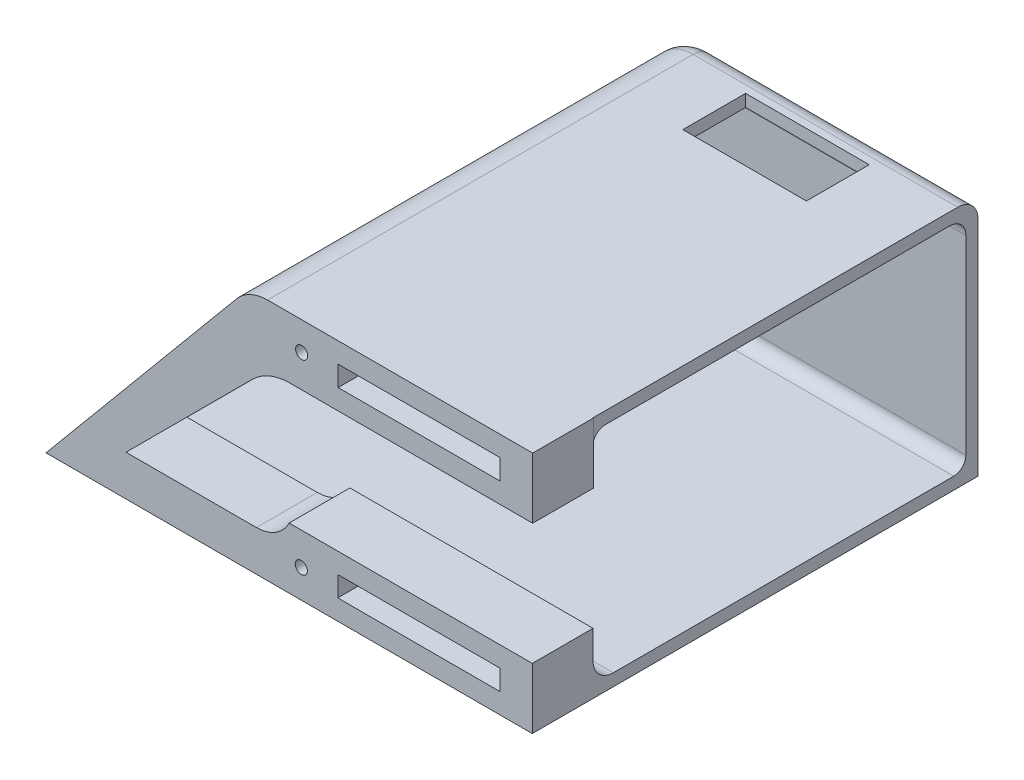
SolidWorks part; units mm, degrees
ref_plane "Front Plane" through (0, 0, 0) normal (0, 0, 1) x (1, 0, 0)
ref_plane "Top Plane" through (0, 0, 0) normal (0, 1, 0) x (1, 0, 0)
ref_plane "Right Plane" through (0, 0, 0) normal (1, 0, 0) x (0, 0, -1)
sketch "Sketch2" plane through (0, 0, 0) normal (0, 0, 1) x (1, 0, 0)
  line L0 (0, 0) -> (120, 0)
  line L1 (120, 0) -> (120, 60)
  line L2 (120, 60) -> (50, 60)
  line L3 (50, 60) -> (0, 0)
  dimension "D1" = 60
  dimension "D2" = 120
  dimension "D3" = 70
  dimension "D4" = 78.1025
extrude "Boss-Extrude1" add sketch "Sketch2" against normal blind 110
shell "Shell1" thickness 3
sketch "Sketch4" plane through (0, 0, 0) normal (0, 0, 1) x (1, 0, 0)
  line L0 (119.75, 50) -> (59.75, 50)
  line L1 (59.75, 50) -> (19.75, 10)
  line L2 (19.75, 10) -> (119.75, 10)
  line L3 (119.75, 10) -> (119.75, 50)
  line L4 (0, 0) -> (120, 0) construction
  line L5 (120, 60) -> (50, 60) construction
  line L6 (120, 0) -> (120, 60) construction
  dimension "D1" = 40
  dimension "D2" = 100
  dimension "D3" = 10
  dimension "D4" = 10
  dimension "D5" = 45
  dimension "D6" = 56.5685
  dimension "D7" = 40
  dimension "D8" = 0.25
extrude "Cut-Extrude1" cut sketch "Sketch4" against normal blind 78
sketch "Sketch5" plane through (0, 0, 0) normal (-0.7682, 0.6402, 0) x (0, 0, 1)
  line L0 (-110, 78.1025) -> (-110, 0) construction
  line L1 (-95, 53.25) -> (-24, 53.25)
  line L2 (-95, 53.25) -> (-95, 29)
  line L3 (-95, 29) -> (-24, 29)
  line L4 (-24, 53.25) -> (-24, 29)
  line L5 (-110, 0) -> (0, 0) construction
  dimension "D1" = 71
  dimension "D2" = 24.25
  dimension "D3" = 15
  dimension "D4" = 29
extrude "Cut-Extrude2" cut sketch "Sketch5" against normal blind 13.642
sketch "Sketch6" plane through (120, 0, 0) normal (1, 0, 0) x (0, 0, -1)
  line L0 (0, 50) -> (3, 50)
  line L1 (0, 0) -> (0, 60) construction
  line L2 (3, 3) -> (3, 57) construction
  line L3 (3, 50) -> (3, 10)
  line L4 (3, 10) -> (0, 10)
  line L5 (0, 10) -> (0, 50)
  line L6 (110, 0) -> (0, 0) construction
  line L7 (110, 60) -> (0, 60) construction
  dimension "D1" = 10
  dimension "D2" = 10
extrude "Cut-Extrude3" cut sketch "Sketch6" against normal blind 13.642
sketch "Sketch7" plane through (0, 0, -3) normal (0, 0, -1) x (-1, 0, 0)
  line L0 (-120, 57) -> (-120, 50)
  line L1 (-120, 50) -> (-59.75, 50)
  line L2 (-59.75, 50) -> (-59.75, 57)
  line L3 (-120, 57) -> (-51.4051, 57) construction
  line L4 (-59.75, 57) -> (-120, 57)
extrude "Boss-Extrude2" add sketch "Sketch7" along normal blind 6
sketch "Sketch8" plane through (0, 0, -3) normal (0, 0, -1) x (-1, 0, 0)
  line L0 (-120, 10) -> (-19.75, 10)
  line L1 (-19.75, 10) -> (-19.75, 3)
  line L2 (-6.4051, 3) -> (-120, 3) construction
  line L3 (-19.75, 3) -> (-120, 3)
  line L4 (-120, 3) -> (-120, 10)
extrude "Boss-Extrude3" add sketch "Sketch8" along normal blind 6
sketch "Sketch9" plane through (0, 0, 0) normal (-0.7682, 0.6402, 0) x (0, 0, 1)
  line L0 (-95, 53.25) -> (-95, 29) construction
  line L1 (-24, 29) -> (-24, 53.25) construction
  circle A0 centre (-98.82, 57.13) radius 1.5
  circle A1 centre (-20.18, 57.13) radius 1.5
  circle A2 centre (-20.18, 25.12) radius 1.5
  circle A3 centre (-98.82, 25.12) radius 1.5
  dimension "D1" = 3
  dimension "D2" = 3
  dimension "D3" = 3
  dimension "D4" = 3
  dimension "D5" = 3.88
  dimension "D6" = 3.82
  dimension "D7" = 3.88
  dimension "D8" = 3.82
  dimension "D9" = 3.88
  dimension "D10" = 3.82
  dimension "D11" = 3.88
  dimension "D12" = 3.82
sketch "Sketch12" plane through (0, 60, 0) normal (0, 1, 0) x (1, 0, 0)
  line L0 (120, 110) -> (120, 0) construction
  line L1 (100, 87.65) -> (69.5, 87.65)
  line L2 (100, 87.65) -> (100, 103.15)
  line L3 (100, 103.15) -> (69.5, 103.15)
  line L4 (69.5, 87.65) -> (69.5, 103.15)
  line L5 (120, 110) -> (50, 110) construction
  dimension "D1" = 30.5
  dimension "D2" = 15.5
  dimension "D3" = 20
  dimension "D4" = 6.85
extrude "Cut-Extrude7" cut sketch "Sketch12" against normal blind 8
sketch "Sketch13" plane through (0, 57, 0) normal (0, -1, 0) x (-1, 0, 0)
fillet "Fillet1" radius 10 1 edges at (50, 60, -55)
fillet "Fillet3" radius 5 3 edges at (23.5008, 28.2009, -110) (87.3419, 60, -110) (50.4422, 59.0559, -110)
extrude "Cut-Extrude13" cut sketch "Sketch9" against normal blind 10
sketch "Sketch17" plane through (0, 0, 0) normal (0, 0, 1) x (1, 0, 0)
  line L2 (19.75, 10) -> (120, 10)
  line L3 (19.75, 10) -> (19.75, 0)
  line L4 (19.75, 0) -> (120, 0)
  line L5 (120, 10) -> (120, 0)
extrude "Boss-Extrude5" add sketch "Sketch17" against normal blind 15
sketch "Sketch18" plane through (0, 0, 0) normal (0, 0, 1) x (1, 0, 0)
  line L1 (54.6837, 60) -> (120, 60)
  line L2 (54.6837, 60) -> (54.6837, 50)
  line L3 (54.6837, 50) -> (120, 50)
  line L4 (120, 60) -> (120, 50)
extrude "Boss-Extrude6" add sketch "Sketch18" against normal blind 15
sketch "Sketch19" plane through (0, 0, 0) normal (0, 0, 1) x (1, 0, 0)
  line L1 (54.6837, 60) -> (120.0963, 60)
  line L2 (54.6837, 60) -> (54.6837, 45)
  line L3 (54.6837, 45) -> (120.0963, 45)
  line L4 (120.0963, 60) -> (120.0963, 45)
  line L5 (19.75, 0) -> (120, 0)
  line L6 (19.75, 10) -> (19.75, 0)
  line L7 (19.75, 0) -> (120, 0)
  line L8 (120, 10) -> (120, 0)
  line L9 (19.75, 0) -> (19.75, 15)
  line L10 (19.75, 15) -> (120, 15)
  line L11 (120, 0) -> (120, 15)
  dimension "D1" = 15
  dimension "D2" = 15
extrude "Boss-Extrude7" add sketch "Sketch19" against normal blind 15 contours L4 L3 L2 L1
sketch "Sketch21" plane through (0, 0, 0) normal (0, 0, 1) x (1, 0, 0)
  line L0 (120.0963, 60) -> (120.0963, 45) construction
  line L1 (72.0963, 55) -> (112.0963, 55)
  line L2 (72.0963, 55) -> (72.0963, 50)
  line L3 (72.0963, 50) -> (112.0963, 50)
  line L4 (112.0963, 55) -> (112.0963, 50)
  line L5 (120.0963, 60) -> (54.6837, 60) construction
  point P4 (112.0963, 52.5)
  point P5 (72.0963, 52.5)
  point P8 (120.0963, 52.5)
  dimension "D1" = 40
  dimension "D2" = 5
  dimension "D3" = 8
  dimension "D4" = 5
extrude "Cut-Extrude15" cut sketch "Sketch21" against normal blind 25
sketch "Sketch25" plane through (0, 0, 0) normal (-0.7682, 0.6402, 0) x (0, 0, 1)
  line L0 (-59.5, 29) -> (-59.5, 0) construction
  line L1 (-95, 29) -> (-24, 29) construction
  line L2 (-105, 0) -> (0, 0) construction
  text T0 "<b>FAB Lab SIBAU</b>" font "Century Gothic" height 5.4
sketch "Sketch26" plane through (0, 0, 0) normal (-0.7682, 0.6402, 0) x (0, 0, 1)
  circle A0 centre (-20.18, 57.13) radius 2.5
  circle A1 centre (-20.18, 25.12) radius 2.5
  circle A2 centre (-98.82, 57.13) radius 2.5
  circle A3 centre (-98.82, 25.12) radius 2.5
  dimension "D1" = 5
extrude "Cut-Extrude19" cut sketch "Sketch26" against normal blind 2
sketch "Sketch27" plane through (0, 10, 0) normal (0, 1, 0) x (1, 0, 0)
  line L0 (120, 15) -> (19.75, 15) construction
  line L1 (120, 0) -> (60, 0)
  line L2 (120, 0) -> (120, 15)
  line L3 (120, 15) -> (60, 15)
  line L4 (60, 0) -> (60, 15)
  dimension "D1" = 60
extrude "Boss-Extrude17" add sketch "Sketch27" along normal blind 5
sketch "Sketch28" plane through (0, 0, 0) normal (0, 0, 1) x (1, 0, 0)
  line L0 (120, 0) -> (120, 15) construction
  line L1 (72, 10) -> (112, 10)
  line L2 (72, 10) -> (72, 5)
  line L3 (72, 5) -> (112, 5)
  line L4 (112, 10) -> (112, 5)
  line L5 (60, 15) -> (120, 15) construction
  dimension "D1" = 8
  dimension "D2" = 5
  dimension "D3" = 40
  dimension "D4" = 5
extrude "Cut-Extrude21" cut sketch "Sketch28" against normal blind 15
fillet "Fillet4" radius 9 1 edges at (60, 10, -7.5)
extrude "Cut-Extrude22" cut sketch "Sketch25" against normal blind 1.5
sketch "Sketch29" plane through (0, 0, 0) normal (0, 0, 1) x (1, 0, 0)
  line L0 (72.0963, 55) -> (72.0963, 50) construction
  line L1 (120.0963, 60) -> (54.6837, 60) construction
  line L2 (0, 0) -> (120, 0) construction
  line L4 (72, 10) -> (72, 5) construction
  circle A0 centre (63.0963, 53) radius 1.5
  circle A1 centre (63, 7) radius 1.5
  point P12 (72, 7.3848)
  dimension "D1" = 3
  dimension "D4" = 3
  dimension "D2" = 9
  dimension "D3" = 7
  dimension "D5" = 7
  dimension "D6" = 9
extrude "Cut-Extrude23" cut sketch "Sketch29" against normal blind 21.5
fillet "Fillet5" radius 13 1 edges at (54.75, 45, -1.5)
fillet "Fillet6" radius 23 1 edges at (54.6837, 57, -9)
fillet "Fillet7" radius 4 1 edges at (85.7026, 57, -107)
fillet "Fillet8" radius 124 1 edges at (19.75, 3, -9)
fillet "Fillet9" radius 5 1 edges at (63.2026, 3, -15)
fillet "Fillet10" radius 3 1 edges at (6.4051, 3, -63.5)
fillet "Fillet11" radius 3 5 edges at (50.4288, 55.8284, -105.8284) (29.2887, 30.4603, -107) (10.0935, 4.7275, -107) (66.4051, 3, -107)
fillet "Fillet12" radius 3 3 edges
fillet "Fillet13" radius 3 2 edges at (10.2076, 7.492, -3)
fillet "Fillet14" radius 1 4 edges at (26.3276, 31.5931, -95) (18.5653, 22.2784, -59.5) (26.3276, 31.5931, -24) (34.0898, 40.9078, -59.5)
fillet "Fillet15" radius 1 4 edges at (14.481, 17.3772, -20.18) (34.9733, 41.9679, -20.18) (14.481, 17.3772, -98.82) (34.9733, 41.9679, -98.82)
